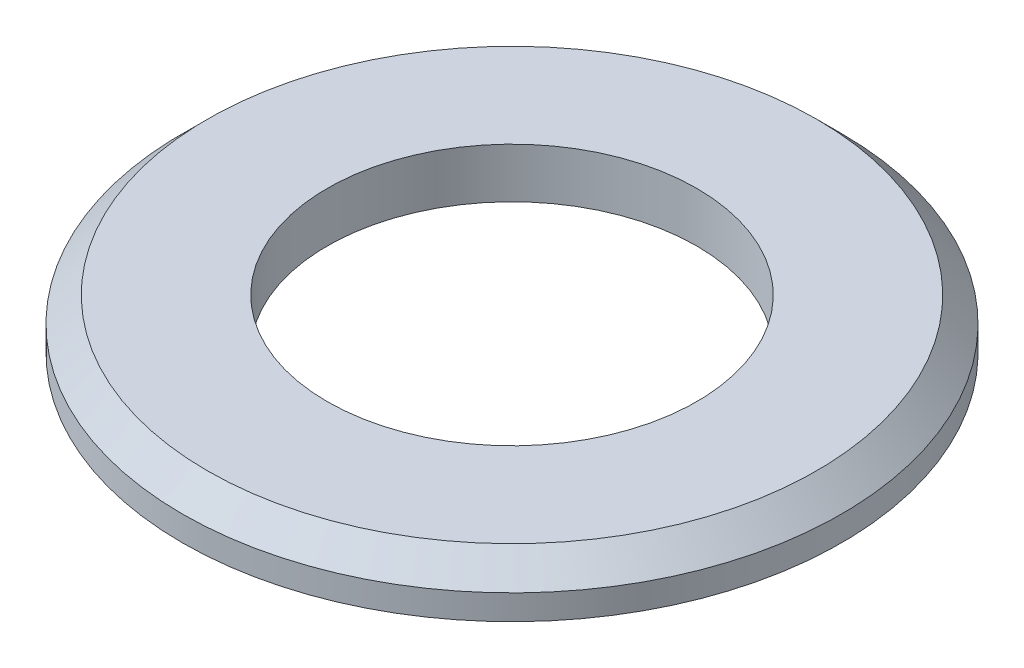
SolidWorks part; units mm, degrees
ref_plane "Front" through (0, 0, 0) normal (0, 0, 1) x (1, 0, 0)
ref_plane "Top" through (0, 0, 0) normal (0, 1, 0) x (1, 0, 0)
ref_plane "Right" through (0, 0, 0) normal (1, 0, 0) x (0, 0, -1)
sketch "Sketch1" plane through (0, 0, 0) normal (0, 1, 0) x (1, 0, 0)
  circle A0 centre (0, 0) radius 18.5
  circle A1 centre (0, 0) radius 33
extrude "Extrude1" add sketch "Sketch1" along normal blind 5
chamfer "Chamfer1" distance 2.5 1 edges at (0, 5, 33)
